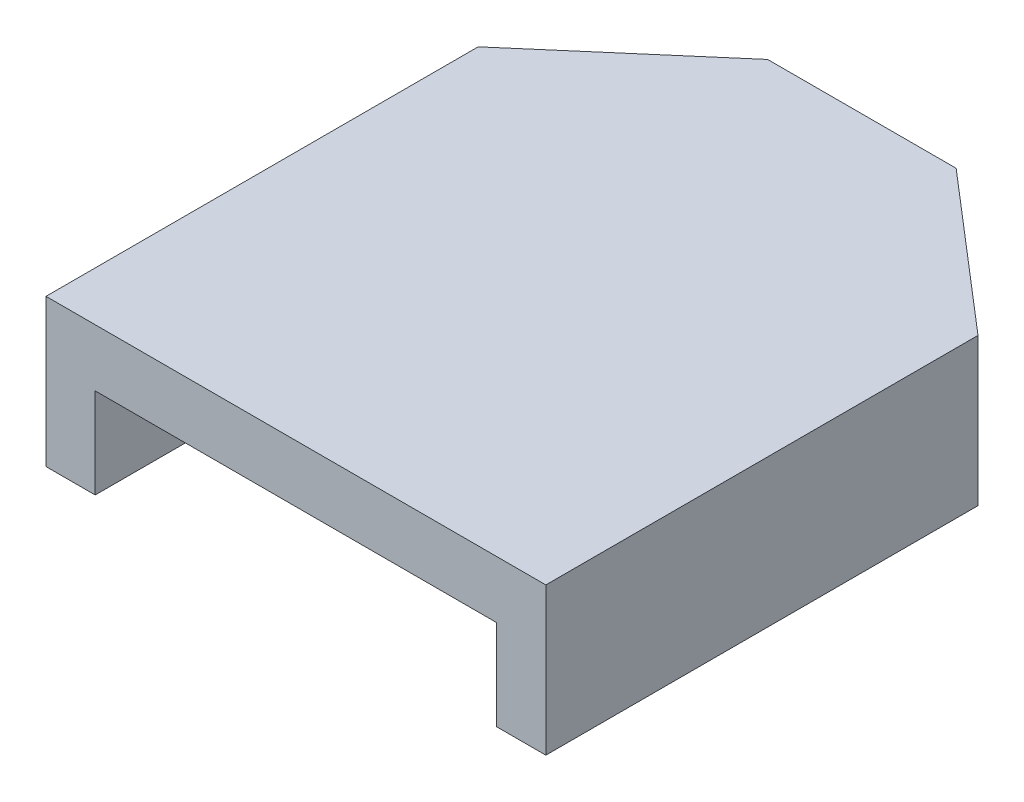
SolidWorks part; units mm, degrees
ref_plane "Front Plane" through (0, 0, 0) normal (0, 0, 1) x (1, 0, 0)
ref_plane "Top Plane" through (0, 0, 0) normal (0, 1, 0) x (1, 0, 0)
ref_plane "Right Plane" through (0, 0, 0) normal (1, 0, 0) x (0, 0, -1)
sketch "Sketch1" plane through (0, 0, 0) normal (0, 1, 0) x (1, 0, 0)
  line L0 (12.192, 0) -> (12.192, 37.8565) construction
  line L1 (0, 0) -> (24.384, 0)
  line L2 (0, 0) -> (0, 21.082)
  line L4 (24.384, 0) -> (24.384, 21.082)
  line L5 (7.5946, 27.6098) -> (16.7894, 27.6098)
  line L6 (0, 21.082) -> (7.5946, 27.6098)
  line L7 (16.7894, 27.6098) -> (24.384, 21.082)
  dimension "D1" = 24.384
  dimension "D2" = 27.6098
  dimension "D3" = 7.5946
  dimension "D4" = 7.5946
  dimension "D5" = 6.5278
extrude "Extrude1" add sketch "Sketch1" along normal blind 2.794
sketch "Sketch2" plane through (0, 0, 0) normal (0, -1, 0) x (1, 0, 0)
  line L0 (12.192, 0) -> (12.192, -27.6098) construction
  line L1 (0, 0) -> (2.4, 0)
  line L2 (0, 0) -> (0, -21.082)
  line L3 (0, -21.082) -> (2.4, -21.082)
  line L4 (2.4, 0) -> (2.4, -21.082)
  line L5 (0, 0) -> (24.384, 0) construction
  line L6 (16.7894, -27.6098) -> (7.5946, -27.6098) construction
  line L7 (21.984, 0) -> (21.984, -21.082)
  line L8 (24.384, -21.082) -> (21.984, -21.082)
  line L9 (24.384, 0) -> (24.384, -21.082)
  line L10 (24.384, 0) -> (21.984, 0)
  dimension "D1" = 2.4
extrude "Extrude2" add sketch "Sketch2" along normal blind 4.4
sketch "Sketch3" plane through (0, -4.4, 0) normal (0, -1, 0) x (1, 0, 0)
  line L0 (0, 0) -> (0, -21.082) construction
  line L1 (16.7894, -27.6098) -> (7.5946, -27.6098) construction
  point P0 (1.1938, -19.8882)
  dimension "D1" = 1.1938
  dimension "D2" = 7.7216
